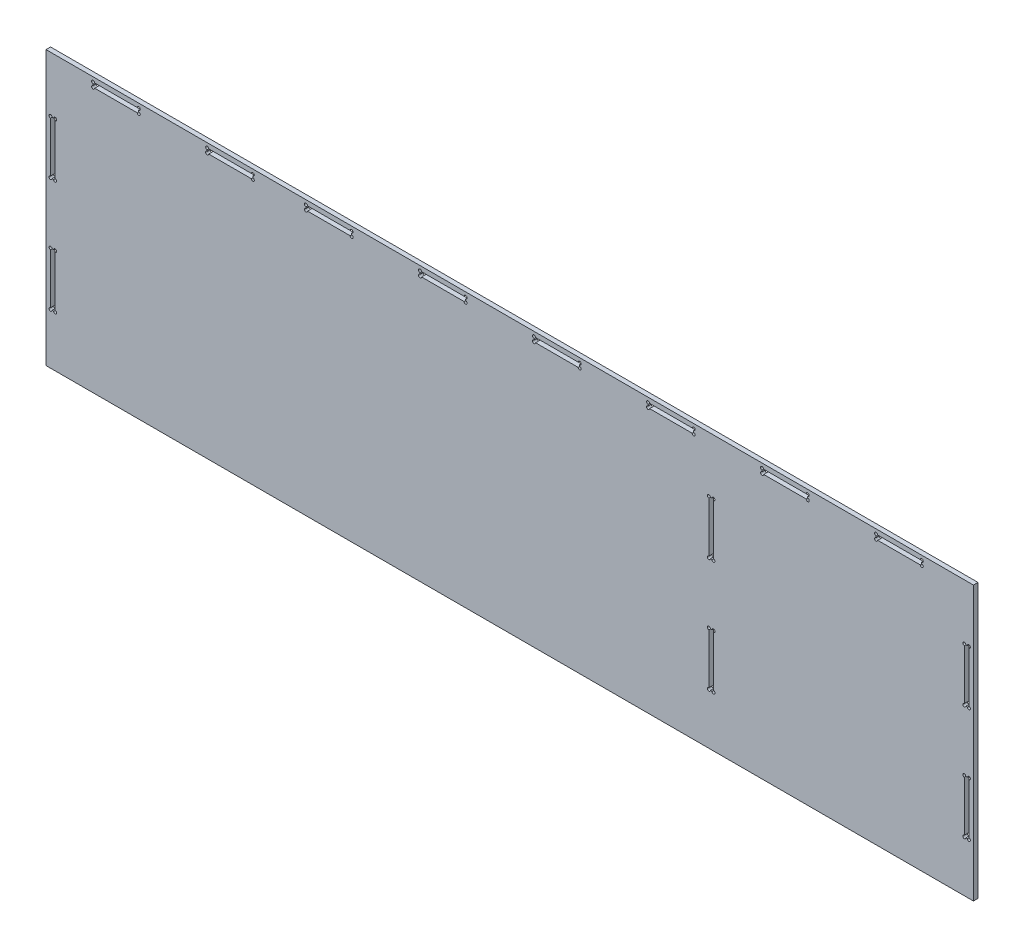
SolidWorks part; units mm, degrees
ref_plane "Front Plane" through (0, 0, 0) normal (0, 0, 1) x (1, 0, 0)
ref_plane "Top Plane" through (0, 0, 0) normal (0, 1, 0) x (1, 0, 0)
ref_plane "Right Plane" through (0, 0, 0) normal (1, 0, 0) x (0, 0, -1)
sketch "Sketch1" plane through (0, 0, 0) normal (0, 0, 1) x (1, 0, 0)
  line L0 (-604, 180) -> (-604, -180) construction
  line L1 (-610, -180) -> (610, -180)
  line L2 (-610, -180) -> (-610, 180)
  line L3 (-610, 180) -> (610, 180)
  line L4 (610, -180) -> (610, 180)
  line L5 (-610, -180) -> (610, 180) construction
  line L6 (-610, 180) -> (610, -180) construction
  line L7 (604, 180) -> (604, -180) construction
  line L8 (-604, 174) -> (604, 174) construction
  line L9 (0, 0) -> (0, 50.7636) construction
  line L10 (-604, 107) -> (-598, 107)
  line L11 (-604, 107) -> (-604, 37)
  line L12 (-604, 37) -> (-598, 37)
  line L13 (-598, 107) -> (-598, 37)
  line L14 (-604, -43) -> (-598, -43)
  line L15 (-604, -43) -> (-604, -113)
  line L16 (-604, -113) -> (-598, -113)
  line L17 (-598, -43) -> (-598, -113)
  line L18 (604, -113) -> (598, -113)
  line L19 (598, -43) -> (598, -113)
  line L20 (604, -43) -> (604, -113)
  line L21 (604, -43) -> (598, -43)
  line L22 (604, 37) -> (598, 37)
  line L23 (604, 107) -> (598, 107)
  line L24 (598, 107) -> (598, 37)
  line L25 (604, 107) -> (604, 37)
  line L26 (265, 174) -> (265, -180) construction
  line L28 (262, 37) -> (268, 37)
  line L29 (262, 37) -> (262, 107)
  line L30 (262, 107) -> (268, 107)
  line L31 (268, 37) -> (268, 107)
  line L32 (262, 37) -> (268, 107) construction
  line L33 (262, 107) -> (268, 37) construction
  line L34 (262, -113) -> (268, -113)
  line L35 (262, -113) -> (262, -43)
  line L36 (262, -43) -> (268, -43)
  line L37 (268, -113) -> (268, -43)
  line L38 (262, -113) -> (268, -43) construction
  line L39 (262, -43) -> (268, -113) construction
  line L40 (-548, 174) -> (-488, 174)
  line L41 (-548, 174) -> (-548, 168)
  line L42 (-548, 168) -> (-488, 168)
  line L43 (-488, 174) -> (-488, 168)
  line L44 (-398, 174) -> (-338, 174)
  line L45 (-398, 174) -> (-398, 168)
  line L46 (-398, 168) -> (-338, 168)
  line L47 (-338, 174) -> (-338, 168)
  line L48 (-268, 174) -> (-208, 174)
  line L49 (-268, 174) -> (-268, 168)
  line L50 (-268, 168) -> (-208, 168)
  line L51 (-208, 174) -> (-208, 168)
  line L52 (-118, 174) -> (-58, 174)
  line L53 (-118, 174) -> (-118, 168)
  line L54 (-118, 168) -> (-58, 168)
  line L55 (-58, 174) -> (-58, 168)
  line L56 (32, 174) -> (92, 174)
  line L57 (32, 174) -> (32, 168)
  line L58 (32, 168) -> (92, 168)
  line L59 (92, 174) -> (92, 168)
  line L60 (332, 174) -> (392, 174)
  line L61 (332, 174) -> (332, 168)
  line L62 (332, 168) -> (392, 168)
  line L63 (392, 174) -> (392, 168)
  line L64 (182, 174) -> (242, 174)
  line L65 (182, 174) -> (182, 175.0479) construction
  line L66 (182, 175.0479) -> (242, 175.0479) construction
  line L67 (242, 174) -> (242, 175.0479) construction
  line L68 (482, 174) -> (542, 174)
  line L69 (482, 174) -> (482, 168)
  line L70 (482, 168) -> (542, 168)
  line L71 (542, 174) -> (542, 168)
  line L72 (182, 174) -> (242, 174)
  line L73 (182, 174) -> (182, 168)
  line L74 (182, 168) -> (242, 168)
  line L75 (242, 174) -> (242, 168)
  circle A0 centre (-604, 107) radius 2
  circle A1 centre (-598, 107) radius 2
  circle A2 centre (-604, 37) radius 2
  circle A3 centre (-598, 37) radius 2
  circle A4 centre (-604, -43) radius 2
  circle A5 centre (-598, -43) radius 2
  circle A6 centre (-604, -113) radius 2
  circle A7 centre (-598, -113) radius 2
  circle A8 centre (598, -113) radius 2
  circle A9 centre (604, -113) radius 2
  circle A10 centre (598, -43) radius 2
  circle A11 centre (604, -43) radius 2
  circle A12 centre (598, 37) radius 2
  circle A13 centre (604, 37) radius 2
  circle A14 centre (598, 107) radius 2
  circle A15 centre (604, 107) radius 2
  circle A16 centre (262, 107) radius 2
  circle A17 centre (268, 107) radius 2
  circle A18 centre (262, 37) radius 2
  circle A19 centre (268, 37) radius 2
  circle A20 centre (268, -43) radius 2
  circle A21 centre (262, -43) radius 2
  circle A22 centre (268, -113) radius 2
  circle A23 centre (262, -113) radius 2
  circle A24 centre (-548, 174) radius 2
  circle A25 centre (-548, 168) radius 2
  circle A26 centre (-488, 174) radius 2
  circle A27 centre (-488, 168) radius 2
  circle A28 centre (-398, 174) radius 2
  circle A29 centre (-398, 168) radius 2
  circle A30 centre (-338, 174) radius 2
  circle A31 centre (-338, 168) radius 2
  circle A32 centre (-268, 174) radius 2
  circle A33 centre (-268, 168) radius 2
  circle A34 centre (-208, 174) radius 2
  circle A35 centre (-208, 168) radius 2
  circle A36 centre (-118, 174) radius 2
  circle A37 centre (-118, 168) radius 2
  circle A38 centre (-58, 174) radius 2
  circle A39 centre (-58, 168) radius 2
  circle A40 centre (32, 174) radius 2
  circle A41 centre (32, 168) radius 2
  circle A42 centre (92, 174) radius 2
  circle A43 centre (92, 168) radius 2
  circle A44 centre (182, 174) radius 2
  circle A45 centre (182, 168) radius 2
  circle A46 centre (242, 174) radius 2
  circle A47 centre (242, 168) radius 2
  circle A48 centre (332, 174) radius 2
  circle A49 centre (332, 168) radius 2
  circle A50 centre (392, 174) radius 2
  circle A51 centre (392, 168) radius 2
  circle A52 centre (482, 174) radius 2
  circle A53 centre (482, 168) radius 2
  circle A54 centre (542, 174) radius 2
  circle A55 centre (542, 168) radius 2
  point P0 (0, 0)
  point P48 (265, 72)
  point P53 (265, -78)
  point P78 (-338, 171)
extrude "Boss-Extrude1" add sketch "Sketch1" along normal blind 6 contours L1 L4 L3 L2 A55 L70 A53 L69 A52 L68 A54 L71 A51 L62 A49 L61 A48 L60 A50 L63 A47 L74 A45 L73 A44 L72 A46 L75 A43 L58 A41 L57 A40 L56 A42 L59 A39 L54 A37 L53 A36 L52 A38 L55 A35
sketch "Sketch2" plane through (0, 0, 6) normal (0, 0, 1) x (1, 0, 0)
  line L0 (-548, 168) -> (-598, 168) construction
  line L2 (-598, 107) -> (-598, 168) construction
  line L3 (542, 168) -> (598, 168) construction
  line L5 (-598, -113) -> (-598, -180) construction
  line L6 (598, 107) -> (598, 168) construction
  line L7 (-610, -180) -> (610, -180) construction
  line L8 (-604, 174) -> (604, 174) construction
  line L9 (-598, 168) -> (598, 168)
  line L10 (-598, 168) -> (-598, 174)
  line L11 (-598, 174) -> (598, 174)
  line L12 (598, 168) -> (598, 174)
  line L14 (-604, 107) -> (-598, 107)
  line L15 (-604, 107) -> (-604, 37)
  line L16 (-604, 37) -> (-598, 37)
  line L17 (-598, 107) -> (-598, 37)
  line L18 (-604, -43) -> (-598, -43)
  line L19 (-604, -43) -> (-604, -113)
  line L20 (-604, -113) -> (-598, -113)
  line L21 (-598, -43) -> (-598, -113)
  line L22 (-548, 174) -> (-488, 174)
  line L23 (-548, 174) -> (-548, 168)
  line L24 (-548, 168) -> (-488, 168)
  line L25 (-488, 174) -> (-488, 168)
  line L26 (-398, 174) -> (-338, 174)
  line L27 (-398, 174) -> (-398, 168)
  line L28 (-398, 168) -> (-338, 168)
  line L29 (-338, 174) -> (-338, 168)
  line L30 (-268, 174) -> (-208, 174)
  line L31 (-268, 174) -> (-268, 168)
  line L32 (-268, 168) -> (-208, 168)
  line L33 (-208, 174) -> (-208, 168)
  line L34 (-118, 174) -> (-58, 174)
  line L35 (-118, 174) -> (-118, 168)
  line L36 (-118, 168) -> (-58, 168)
  line L37 (-58, 174) -> (-58, 168)
  line L38 (32, 174) -> (92, 174)
  line L39 (32, 174) -> (32, 168)
  line L40 (32, 168) -> (92, 168)
  line L41 (92, 174) -> (92, 168)
  line L42 (182, 174) -> (242, 174)
  line L43 (182, 174) -> (182, 168)
  line L44 (182, 168) -> (242, 168)
  line L45 (242, 174) -> (242, 168)
  line L46 (332, 174) -> (392, 174)
  line L47 (332, 174) -> (332, 168)
  line L48 (332, 168) -> (392, 168)
  line L49 (392, 174) -> (392, 168)
  line L50 (482, 174) -> (542, 174)
  line L51 (482, 174) -> (482, 168)
  line L52 (482, 168) -> (542, 168)
  line L53 (542, 174) -> (542, 168)
  line L54 (598, 107) -> (604, 107)
  line L55 (598, 107) -> (598, 37)
  line L56 (598, 37) -> (604, 37)
  line L57 (604, 107) -> (604, 37)
  line L58 (598, -43) -> (604, -43)
  line L59 (598, -43) -> (598, -113)
  line L60 (598, -113) -> (604, -113)
  line L61 (604, -43) -> (604, -113)
  line L62 (262, 107) -> (268, 107)
  line L63 (262, 107) -> (262, 37)
  line L64 (262, 37) -> (268, 37)
  line L65 (268, 107) -> (268, 37)
  line L66 (262, -43) -> (268, -43)
  line L67 (262, -43) -> (262, -113)
  line L68 (262, -113) -> (268, -113)
  line L69 (268, -43) -> (268, -113)
  line L70 (598, 174) -> (604, 174)
  line L71 (598, 174) -> (598, -180)
  line L72 (598, -180) -> (604, -180)
  line L73 (604, 174) -> (604, -180)
  line L74 (-598, 174) -> (-604, 174)
  line L75 (-598, 174) -> (-598, -180)
  line L76 (-598, -180) -> (-604, -180)
  line L77 (-604, 174) -> (-604, -180)
  line L78 (232, 168) -> (238, 168)
  line L79 (232, 168) -> (232, -180)
  line L80 (232, -180) -> (238, -180)
  line L81 (238, 168) -> (238, -180)
equation "\"D39@Sketch1\"=\"D37@Sketch1\""
equation "\"D41@Sketch1\"=\"D39@Sketch1\""
equation "\"D43@Sketch1\"=\"D38@Sketch1\""
equation "\"D44@Sketch1\"=\"D43@Sketch1\""
equation "\"D45@Sketch1\"=\"D42@Sketch1\""
equation "\"D46@Sketch1\"=\"D44@Sketch1\""
equation "\"D47@Sketch1\"=\"D45@Sketch1\""
equation "\"D48@Sketch1\"=\"D46@Sketch1\""
equation "\"D49@Sketch1\"=\"D47@Sketch1\""
equation "\"D50@Sketch1\"=\"D49@Sketch1\""
equation "\"D51@Sketch1\"=\"D48@Sketch1\""
